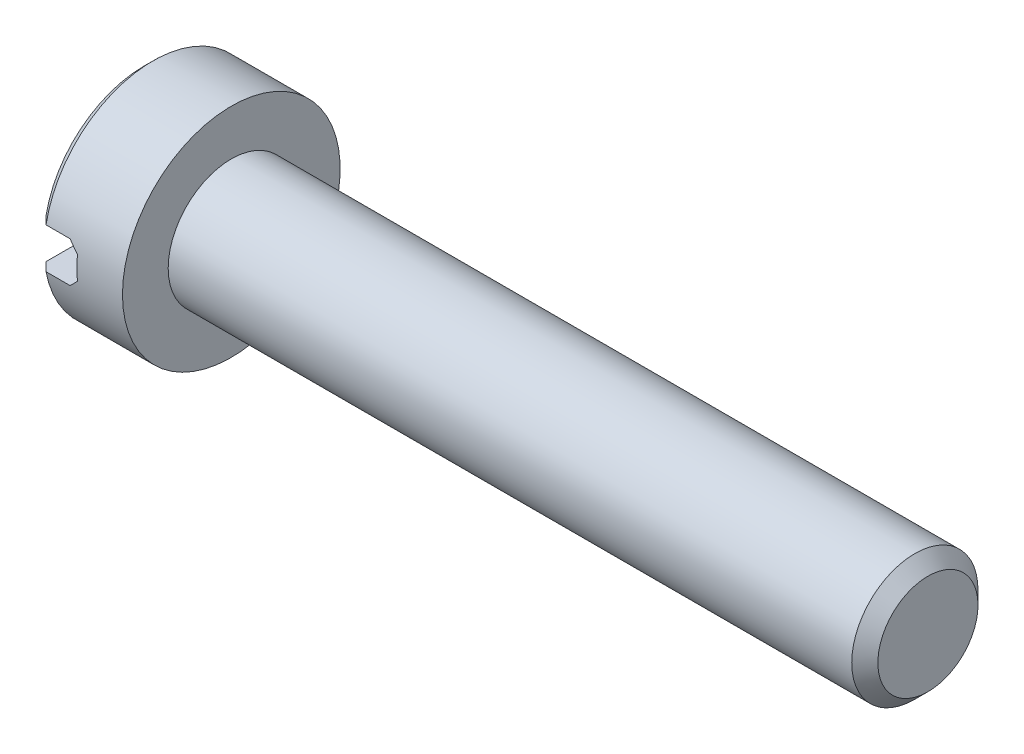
SolidWorks part; units mm, degrees
ref_plane "Face" through (0, 0, 0) normal (0, 0, 1) x (1, 0, 0)
ref_plane "Dessus" through (0, 0, 0) normal (0, 1, 0) x (1, 0, 0)
ref_plane "Droite" through (0, 0, 0) normal (1, 0, 0) x (0, 0, -1)
sketch "Esquisse1" plane through (0, 0, 0) normal (0, 0, 1) x (1, 0, 0)
  line L0 (0, 0) -> (0, 2.3)
  line L1 (0.2, 2.5) -> (2, 2.5)
  line L2 (2, 2.5) -> (2, 0)
  line L5 (0, 0) -> (7.6423, 0) construction
  line L7 (0, 2.3) -> (0.2, 2.5)
  line L8 (0, 0) -> (2, 0)
  point P1 (0, 2.5)
  dimension "D1" = 2.5
  dimension "D3" = 2
revolve "Révolution1" add sketch "Esquisse1" angle 360 about L5
sketch "Esquisse2" plane through (0, 0, 0) normal (0, 0, 1) x (1, 0, 0)
  line L0 (0, 2.3) -> (0, -2.3) construction
  line L1 (0, 0.4655) -> (0.7534, 0.4655)
  line L2 (0, 0.4655) -> (0, -0.4655)
  line L3 (0, -0.4655) -> (0.7534, -0.4655)
  line L4 (0.9534, 0.2655) -> (0.9534, -0.2655)
  line L5 (0.7534, 0.4655) -> (0.9534, 0.2655)
  line L6 (0.7534, -0.4655) -> (0.9534, -0.2655)
  point P1 (0.9534, -0.4655)
  point P3 (0.9534, 0.4655)
extrude "Enlèv. mat.-Extru.1" cut sketch "Esquisse2" against normal mid plane 10
sketch "Esquisse3" plane through (2, 0, 0) normal (1, 0, 0) x (0, 0, -1)
  circle A0 centre (0, 0) radius 1.45
extrude "Extrusion1" add sketch "Esquisse3" along normal blind 16
chamfer "Chanfrein1" distance 0.3 angle 45 1 edges at (18, 0, -1.45)
